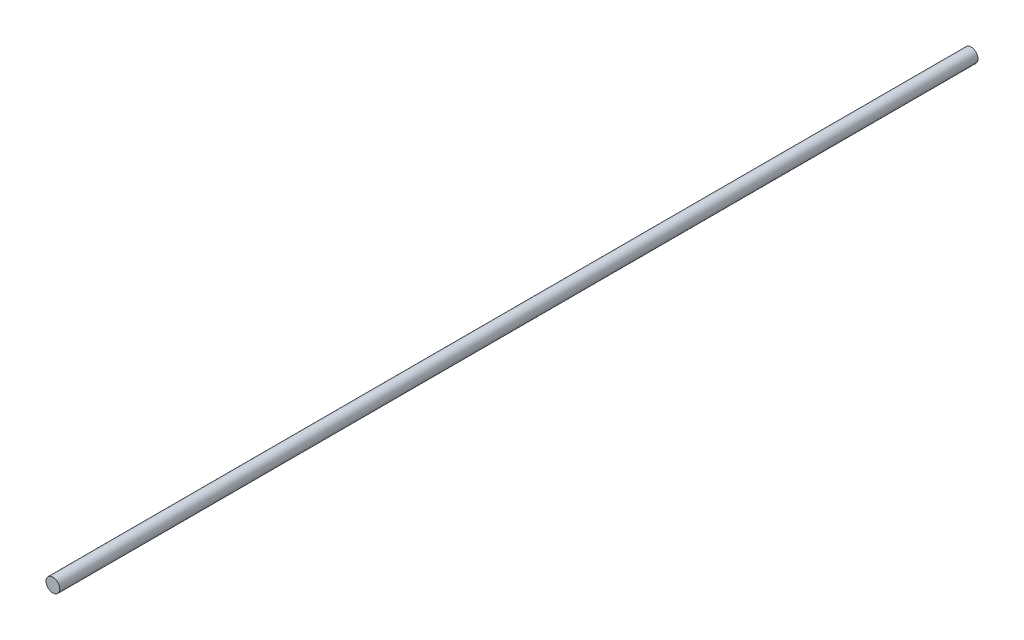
SolidWorks part; units mm, degrees
ref_plane "Front Plane" through (0, 0, 0) normal (0, 0, 1) x (1, 0, 0)
ref_plane "Top Plane" through (0, 0, 0) normal (0, 1, 0) x (1, 0, 0)
ref_plane "Right Plane" through (0, 0, 0) normal (1, 0, 0) x (0, 0, -1)
sketch "Sketch1" plane through (0, 0, 0) normal (0, 0, 1) x (1, 0, 0)
  circle A0 centre (0, 0) radius 4.7625
extrude "Extrude1" add sketch "Sketch1" along normal blind 635
